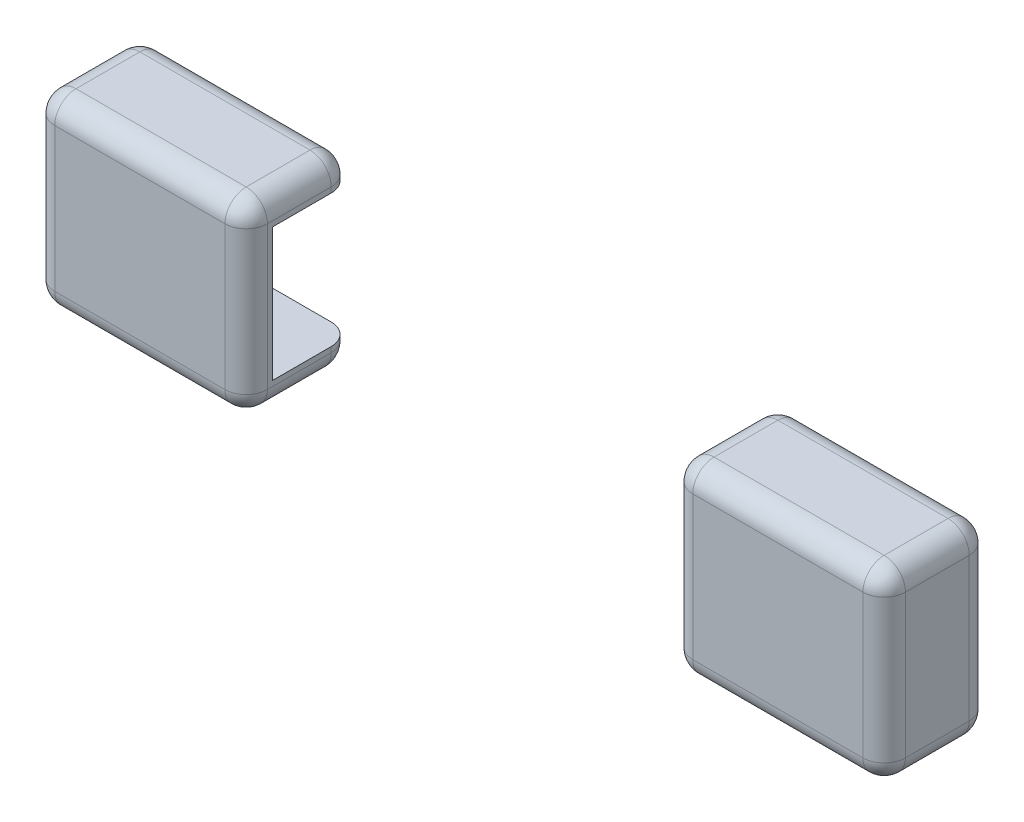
SolidWorks part; units mm, degrees
ref_plane "Front Plane" through (0, 0, 0) normal (0, 0, 1) x (1, 0, 0)
ref_plane "Top Plane" through (0, 0, 0) normal (0, 1, 0) x (1, 0, 0)
ref_plane "Right Plane" through (0, 0, 0) normal (1, 0, 0) x (0, 0, -1)
sketch "Skizze2" plane through (0, 0, 0) normal (0, 0, 1) x (1, 0, 0)
  line L8 (37.25, 6) -> (37.5, 6)
  line L9 (37.25, 6) -> (37.5, 6)
  line L10 (37.5, 6) -> (37.5, 8)
  line L11 (37.5, 6) -> (37.5, 8)
  line L12 (35.5, 10) -> (-35.5, 10)
  line L13 (35.5, 10) -> (-35.5, 10)
  line L14 (-37.5, 8) -> (-37.5, 6)
  line L15 (-37.5, 8) -> (-37.5, 6)
  line L36 (-37.5, 6) -> (-37.25, 6)
  line L37 (-37.5, 6) -> (-37.25, 6)
  line L38 (-37.25, 6) -> (-37.25, 1.5)
  line L39 (-37.25, 6) -> (-37.25, 1.5)
  line L40 (-37.25, 1.5) -> (-37.5, 1.5)
  line L41 (-37.25, 1.5) -> (-37.5, 1.5)
  line L42 (-37.5, 1.5) -> (-37.5, -0.5)
  line L43 (-37.5, 1.5) -> (-37.5, -0.5)
  line L44 (-35.5, -2.5) -> (35.5, -2.5)
  line L45 (-35.5, -2.5) -> (35.5, -2.5)
  line L46 (37.5, -0.5) -> (37.5, 1.5)
  line L47 (37.5, -0.5) -> (37.5, 1.5)
  line L48 (37.5, 1.5) -> (37.25, 1.5)
  line L49 (37.5, 1.5) -> (37.25, 1.5)
  line L50 (37.25, 1.5) -> (37.25, 6)
  line L51 (37.25, 1.5) -> (37.25, 6)
  arc A8 (37.5, 8) -> (35.5, 10) centre (35.5, 8) ccw
  arc A9 (37.5, 8) -> (35.5, 10) centre (35.5, 8) ccw
  arc A10 (-35.5, 10) -> (-37.5, 8) centre (-35.5, 8) ccw
  arc A11 (-35.5, 10) -> (-37.5, 8) centre (-35.5, 8) ccw
  arc A12 (-37.5, -0.5) -> (-35.5, -2.5) centre (-35.5, -0.5) ccw
  arc A13 (-37.5, -0.5) -> (-35.5, -2.5) centre (-35.5, -0.5) ccw
  arc A14 (35.5, -2.5) -> (37.5, -0.5) centre (35.5, -0.5) ccw
  arc A15 (35.5, -2.5) -> (37.5, -0.5) centre (35.5, -0.5) ccw
  dimension "D1" = 0
extrude "Linear austragen1" add sketch "Skizze2" against normal blind 7.5 and the other way blind 2.5
sketch "Skizze4" plane through (0, 0, 2.5) normal (0, 0, 1) x (1, 0, 0)
  line L16 (37.25, 1.5) -> (37.25, 6)
  line L17 (37.25, 1.5) -> (37.25, 6)
  line L18 (37.25, 6) -> (37.5, 6)
  line L19 (37.25, 6) -> (37.5, 6)
  line L20 (37.5, 6) -> (37.5, 8)
  line L21 (37.5, 6) -> (37.5, 8)
  line L22 (35.5, 10) -> (-35.5, 10)
  line L23 (35.5, 10) -> (-35.5, 10)
  line L32 (-37.5, 8) -> (-37.5, 6)
  line L33 (-37.5, 8) -> (-37.5, 6)
  line L34 (-37.5, 6) -> (-37.25, 6)
  line L35 (-37.5, 6) -> (-37.25, 6)
  line L36 (-37.25, 6) -> (-37.25, 1.5)
  line L37 (-37.25, 6) -> (-37.25, 1.5)
  line L38 (-37.25, 1.5) -> (-37.5, 1.5)
  line L39 (-37.25, 1.5) -> (-37.5, 1.5)
  line L40 (-37.5, 1.5) -> (-37.5, -0.5)
  line L41 (-37.5, 1.5) -> (-37.5, -0.5)
  line L42 (-35.5, -2.5) -> (35.5, -2.5)
  line L43 (-35.5, -2.5) -> (35.5, -2.5)
  line L44 (37.5, -0.5) -> (37.5, 1.5)
  line L45 (37.5, -0.5) -> (37.5, 1.5)
  line L46 (37.5, 1.5) -> (37.25, 1.5)
  line L47 (37.5, 1.5) -> (37.25, 1.5)
  arc A8 (37.5, 8) -> (35.5, 10) centre (35.5, 8) ccw
  arc A9 (37.5, 8) -> (35.5, 10) centre (35.5, 8) ccw
  arc A10 (-35.5, 10) -> (-37.5, 8) centre (-35.5, 8) ccw
  arc A11 (-35.5, 10) -> (-37.5, 8) centre (-35.5, 8) ccw
  arc A12 (-37.5, -0.5) -> (-35.5, -2.5) centre (-35.5, -0.5) ccw
  arc A13 (-37.5, -0.5) -> (-35.5, -2.5) centre (-35.5, -0.5) ccw
  arc A14 (35.5, -2.5) -> (37.5, -0.5) centre (35.5, -0.5) ccw
  arc A15 (35.5, -2.5) -> (37.5, -0.5) centre (35.5, -0.5) ccw
  dimension "D1" = 0
sketch "Skizze3" plane through (0, 0, -7.5) normal (0, 0, -1) x (-1, 0, 0)
  line L0 (-35.5, 10) -> (35.5, 10) construction
  line L1 (40, 12.5) -> (-40, 12.5)
  line L2 (40, 12.5) -> (40, -5)
  line L3 (40, -5) -> (-40, -5)
  line L4 (-40, 12.5) -> (-40, -5)
  line L5 (35.5, -2.5) -> (-35.5, -2.5) construction
  line L6 (-37.5, 6) -> (-37.5, 8) construction
  line L7 (37.5, 8) -> (37.5, 6) construction
  point P8 (-37.5, 7)
  point P11 (37.5, 7)
  dimension "D1" = 2.5
  dimension "D2" = 2.5
  dimension "D3" = 2.5
  dimension "D4" = 2.5
extrude "Linear austragen2" add sketch "Skizze3" against normal up to surface (10 mm away)
extrude "Schnitt-Linear austragen1" cut sketch "Skizze4" against normal through all
sketch "Skizze10" plane through (0, 0, 2.5) normal (0, 0, 1) x (1, 0, 0)
  line L4 (-40, 12.5) -> (-40, -5)
  line L5 (-40, -5) -> (40, -5)
  line L6 (40, -5) -> (40, 12.5)
  line L7 (40, 12.5) -> (-40, 12.5)
  line L8 (-40, 12.5) -> (-40, -5)
  line L9 (-40, -5) -> (40, -5)
  line L10 (40, -5) -> (40, 12.5)
  line L11 (40, 12.5) -> (-40, 12.5)
  dimension "D1" = 0
extrude "Linear austragen3" add sketch "Skizze10" against normal blind 2.5
sketch "Skizze11" plane through (0, 0, 2.5) normal (0, 0, 1) x (1, 0, 0)
  line L0 (-40, -5) -> (-40, 12.5) construction
  line L1 (-20, 22.0476) -> (20, 22.0476)
  line L2 (-20, 22.0476) -> (-20, -12.8115)
  line L3 (-20, -12.8115) -> (20, -12.8115)
  line L4 (20, 22.0476) -> (20, -12.8115)
  line L5 (40, 12.5) -> (40, -5) construction
  dimension "D1" = 20
  dimension "D2" = 20
extrude "Schnitt-Linear austragen2" cut sketch "Skizze11" against normal through all
fillet "Verrundung4" radius 2 13 edges at (-30, 12.5, 2.5) (-30, -5, 2.5) (-40, -5, -2.5) (-30, 12.5, -7.5) (-20, 11.25, -7.5) (-20, -3.75, -7.5) (-30, -5, -7.5) (-40, 3.75, -7.5) (-40, 12.5, -2.5) (-40, 3.75, 2.5) (-20, 12.5, -2.5) (-20, 3.75, 2.5) (-20, -5, -2.5)
fillet "Verrundung6" radius 2 13 edges at (30, 12.5, 2.5) (30, 12.5, -7.5) (20, 12.5, -2.5) (20, -5, -2.5) (20, -3.75, -7.5) (20, 11.25, -7.5) (20, 3.75, 2.5) (40, 3.75, -7.5) (30, -5, -7.5) (40, 12.5, -2.5) (40, 3.75, 2.5) (40, -5, -2.5) (30, -5, 2.5)
